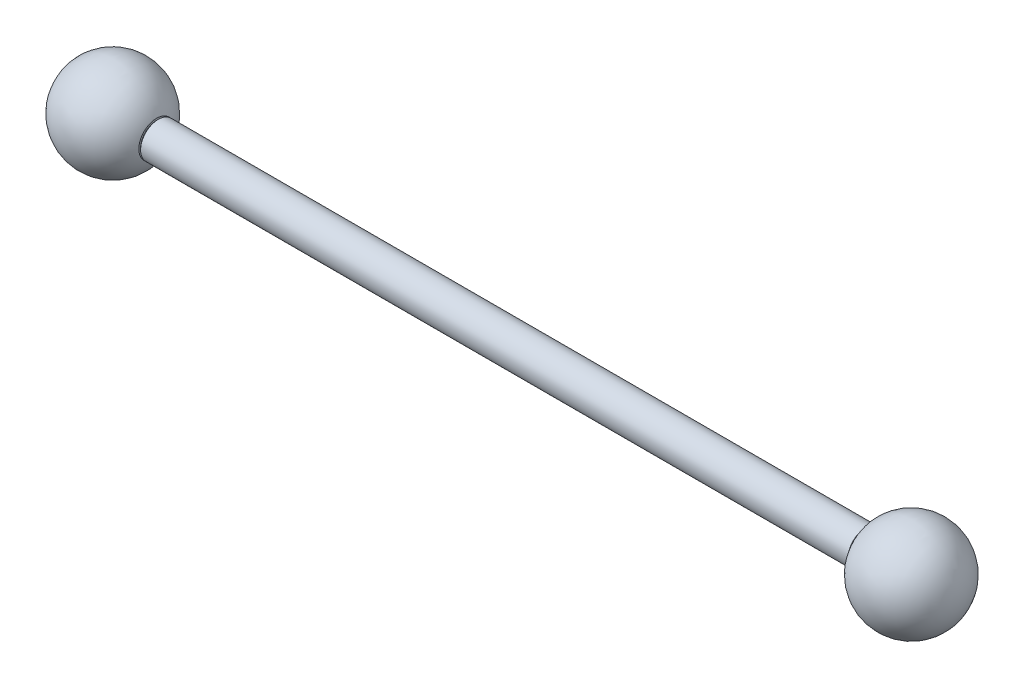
SolidWorks part; units mm, degrees
ref_plane "Спереди" through (0, 0, 0) normal (0, 0, 1) x (1, 0, 0)
ref_plane "Сверху" through (0, 0, 0) normal (0, 1, 0) x (1, 0, 0)
ref_plane "Справа" through (0, 0, 0) normal (1, 0, 0) x (0, 0, -1)
sketch "Эскиз2" plane through (0, 0, 0) normal (0, 0, 1) x (1, 0, 0)
  line L0 (0, 19.0493) -> (0, -18.754) construction
  line L1 (-33.75, 0) -> (33.75, 0) construction
  line L2 (-30.0419, 1.5) -> (30.0419, 1.5) construction
  line L3 (-30.0419, 1.5) -> (-30.0419, -1.5) construction
  line L4 (30.0419, 1.5) -> (30.0419, -1.5) construction
  line L5 (30.0419, 1.5) -> (30.0419, 1)
  line L6 (30.0419, 1) -> (33.1491, 1)
  line L7 (33.1491, 1) -> (33.75, 0)
  line L8 (33.75, 0) -> (37.75, 0)
  line L9 (-33.75, 0) -> (-37.75, 0)
  line L10 (-33.1491, 1) -> (-33.75, 0)
  line L11 (-30.0419, 1) -> (-33.1491, 1)
  line L12 (-30.0419, 1.5) -> (-30.0419, 1)
  arc A0 (-30.0419, 1.5) -> (-37.75, 0) centre (-33.75, 0) ccw
  arc A1 (30.0419, 1.5) -> (37.75, 0) centre (33.75, 0) cw
  dimension "D1" = 8
  dimension "D2" = 67.5
  dimension "D3" = 1.5
  dimension "D4" = 59
  dimension "D5" = 2
revolve "Повернуть1" add sketch "Эскиз2" angle 360 about L1
chamfer "Фаска1" distance 0.15 angle 45 1 edges at (-30.0419, -1, 0)
chamfer "Фаска2" distance 0.15 angle 45 1 edges at (30.0419, -1, 0)
sketch "Эскиз3" plane through (0, 0, 0) normal (0, 0, 1) x (1, 0, 0)
  line L0 (-33.75, 0) -> (33.75, 0) construction
  line L1 (-33.1491, 0) -> (33.1491, 0)
  line L2 (-30.0419, 1) -> (-33.1491, 1) construction
  line L3 (-30.0419, 1.5) -> (-30.0419, 1) construction
  line L4 (-30.0419, 1.5) -> (30.0419, 1.5) construction
  line L5 (30.0419, 1.5) -> (30.0419, 1) construction
  line L6 (30.0419, 1) -> (33.1491, 1) construction
  line L7 (-30.1919, 1) -> (-32.9991, 1)
  line L8 (-30.0419, 1.35) -> (-30.0419, 1.15)
  line L9 (-29.8919, 1.5) -> (29.8919, 1.5)
  line L10 (30.0419, 1.35) -> (30.0419, 1.15)
  line L11 (30.1919, 1) -> (32.9991, 1)
  line L12 (33.1491, 0.85) -> (33.1491, 0)
  line L13 (-33.1491, 0.85) -> (-33.1491, 0)
  line L14 (29.8919, 1.5) -> (30.0419, 1.35)
  line L15 (30.0419, 1.15) -> (30.1919, 1)
  line L16 (32.9991, 1) -> (33.1491, 0.85)
  line L17 (-29.8919, 1.5) -> (-30.0419, 1.35)
  line L18 (-30.0419, 1.15) -> (-30.1919, 1)
  line L19 (-32.9991, 1) -> (-33.1491, 0.85)
  dimension "D3" = 0.15
  dimension "D4" = 0.15
  dimension "D5" = 0.15
  dimension "D6" = 0.15
  dimension "D7" = 0.15
  dimension "D8" = 0.15
revolve "Повернуть2" add sketch "Эскиз3" angle 360 about L1
